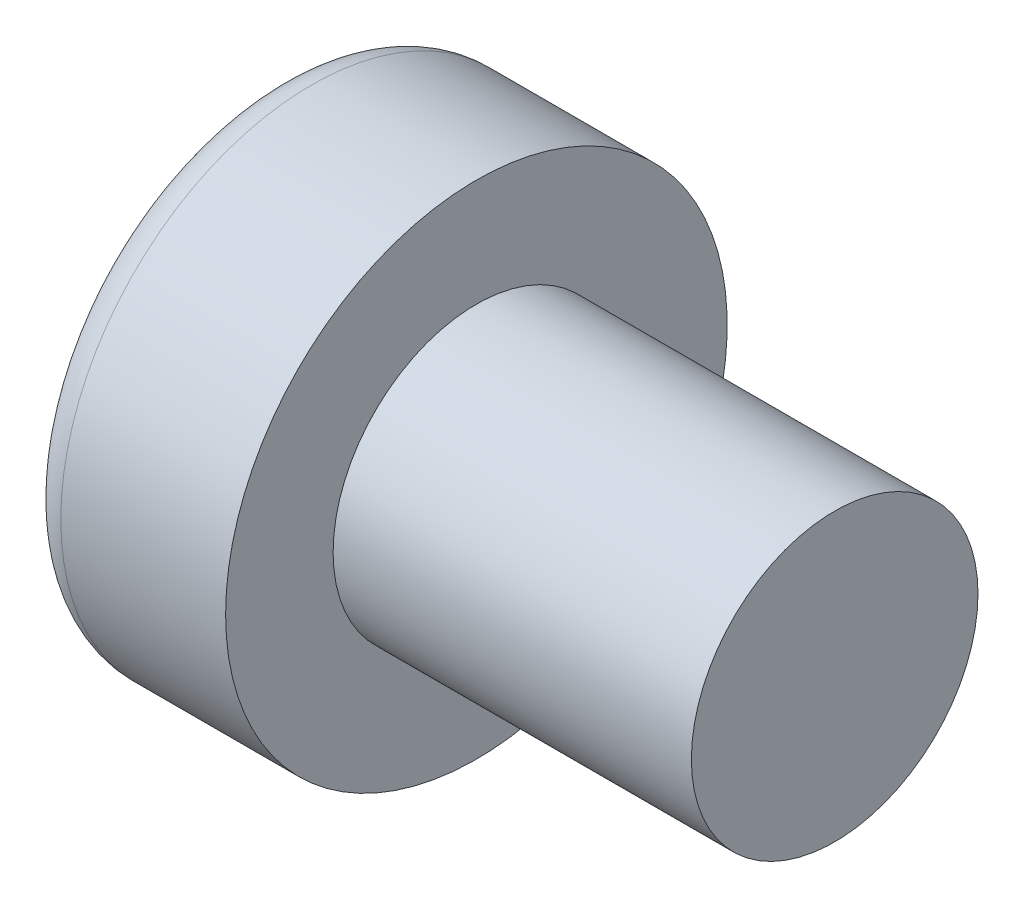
SolidWorks part; units mm, degrees
ref_plane "Ebene vorne" through (0, 0, 0) normal (0, 0, 1) x (1, 0, 0)
ref_plane "Ebene oben" through (0, 0, 0) normal (0, 1, 0) x (1, 0, 0)
ref_plane "Ebene rechts" through (0, 0, 0) normal (1, 0, 0) x (0, 0, -1)
sketch "Skizze1" plane through (0, 0, 0) normal (0, 0, 1) x (1, 0, 0)
  line L0 (-65.0118, 0) -> (64.6036, 0) construction
  line L1 (-7.8, 0) -> (-7.8, 3.5)
  line L2 (-7.8, 3.5) -> (-5, 3.5)
  line L3 (-5, 3.5) -> (-5, 2)
  line L4 (-5, 2) -> (0, 2)
  line L5 (0, 2) -> (0, 0)
  line L6 (0, 0) -> (-7.8, 0)
  dimension "D1" = 4
  dimension "D2" = 5
  dimension "D3" = 7
  dimension "D4" = 2.8
revolve "Rotation1" add sketch "Skizze1" angle 360 about L0
fillet "Verrundung1" radius 0.5 1 edges at (-7.8, 0, 3.5)
sketch "Skizze2" plane through (-7.8, 0, 0) normal (-1, 0, 0) x (0, 0, 1)
  line L1 (1.25, 0.7217) -> (0, 1.4434)
  line L2 (0, 1.4434) -> (-1.25, 0.7217)
  line L3 (-1.25, 0.7217) -> (-1.25, -0.7217)
  line L4 (-1.25, -0.7217) -> (0, -1.4434)
  line L5 (0, -1.4434) -> (1.25, -0.7217)
  line L6 (1.25, -0.7217) -> (1.25, 0.7217)
  circle A0 centre (0, 0) radius 1.25 construction
  dimension "D1" = 2.5
extrude "Schnitt-Linear austragen1" cut sketch "Skizze2" against normal blind 3
